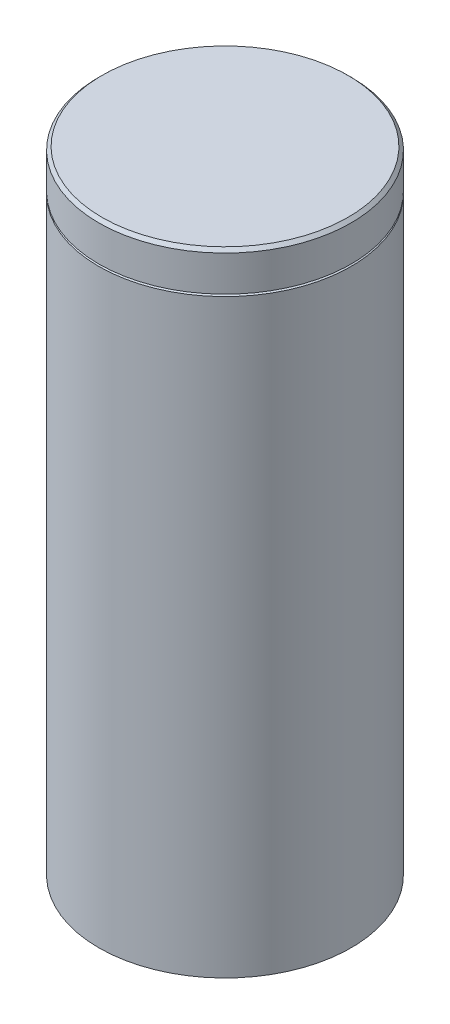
SolidWorks part; units mm, degrees
ref_plane "Front Plane" through (0, 0, 0) normal (0, 0, 1) x (1, 0, 0)
ref_plane "Top Plane" through (0, 0, 0) normal (0, 1, 0) x (1, 0, 0)
ref_plane "Right Plane" through (0, 0, 0) normal (1, 0, 0) x (0, 0, -1)
sketch "Sketch1" plane through (0, 0, 0) normal (0, 1, 0) x (1, 0, 0)
  circle A0 centre (0, 0) radius 20.1168
  dimension "D1" = 40.2336
extrude "Boss-Extrude1" add sketch "Sketch1" along normal blind 100.584
sketch "Sketch2" plane through (0, 0, 0) normal (0, -1, 0) x (1, 0, 0)
  circle A0 centre (0, 0) radius 10.16
  dimension "D1" = 20.32
extrude "Cut-Extrude1" cut sketch "Sketch2" against normal blind 2.794
chamfer "Chamfer1" distance 2.54 angle 45 1 edges at (0, 0, -10.16)
sketch "Sketch3" plane through (0, 0, 0) normal (0, -1, 0) x (1, 0, 0)
  circle A0 centre (0, 0) radius 18.9171
  circle A1 centre (0, 0) radius 18.7114
extrude "Cut-Extrude2" cut sketch "Sketch3" against normal blind 0.254
chamfer "Chamfer2" distance 0.508 angle 45 1 edges at (0, 100.584, 20.1168)
sketch "Sketch4" plane through (0, 0, 0) normal (1, 0, 0) x (0, 0, -1)
  line L0 (0, 22.1285) -> (0, -22.1285) construction
  line L1 (35.4902, 85.1921) -> (35.4902, 103.2759)
  line L2 (35.4902, 103.2759) -> (19.8291, 94.234)
  line L3 (19.8291, 94.234) -> (35.4902, 85.1921)
  line L4 (19.6088, 100.584) -> (-19.6088, 100.584) construction
  line L5 (0, 100.584) -> (0, 83.2985) construction
  circle A0 centre (30.2698, 94.234) radius 5.2204 construction
  dimension "D1" = 6.35
revolve "Cut-Revolve1" cut sketch "Sketch4" angle 360 about L5
